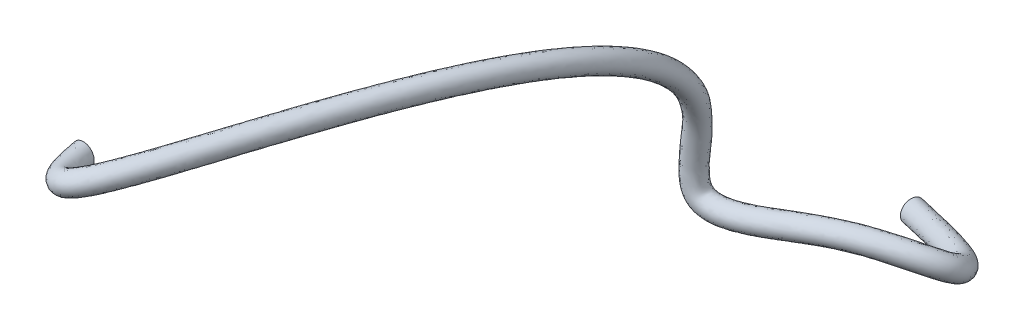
SolidWorks part; units mm, degrees
ref_plane "Plan de face" through (0, 0, 0) normal (0, 0, 1) x (1, 0, 0)
ref_plane "Plan de dessus" through (0, 0, 0) normal (0, 1, 0) x (1, 0, 0)
ref_plane "Plan de droite" through (0, 0, 0) normal (1, 0, 0) x (0, 0, -1)
sketch "Esquisse1" plane through (0, 0, 0) normal (0, 0, 1) x (1, 0, 0)
  circle A0 centre (-2.15, 7.8358) radius 0.5 construction
  circle A1 centre (-2.15, 7.8358) radius 0.5
sketch3d "Esquisse3D1"
  spline S0 degree 3 poles (-2.15, 7.8358, 0) (-2.0801, 7.8532, 0.2979) (-0.2147, 8.3167, 8.2451) (8.8726, 12.9775, -21.1671) (5.4968, -1.008, -19.5213) (11.3256, 1.5849, -20.8315) (16.4208, -0.512, -24.0619) (12.3856, -1.1768, -25.4953) (9.9238, -1.5824, -26.3699) knots 0 0 0 0 0.020986 0.559939 0.643517 0.776954 0.86392 1 1 1 1
sweep "Balayage3" add profiles "Esquisse1" path "Esquisse3D1"
sketch "Esquisse2" plane through (5.9818, 0.1411, 0.8571) normal (-0.9896, -0.0233, -0.1418) x (-0.1043, 0.7952, 0.5973)
  point P0 (2.03, -15.5962)
sketch "Esquisse3" plane through (5.9818, 0.1411, 0.8571) normal (-0.9896, -0.0233, -0.1418) x (-0.1101, 0.7573, 0.6437)
  point P0 (-19.2015, -26.0897)
